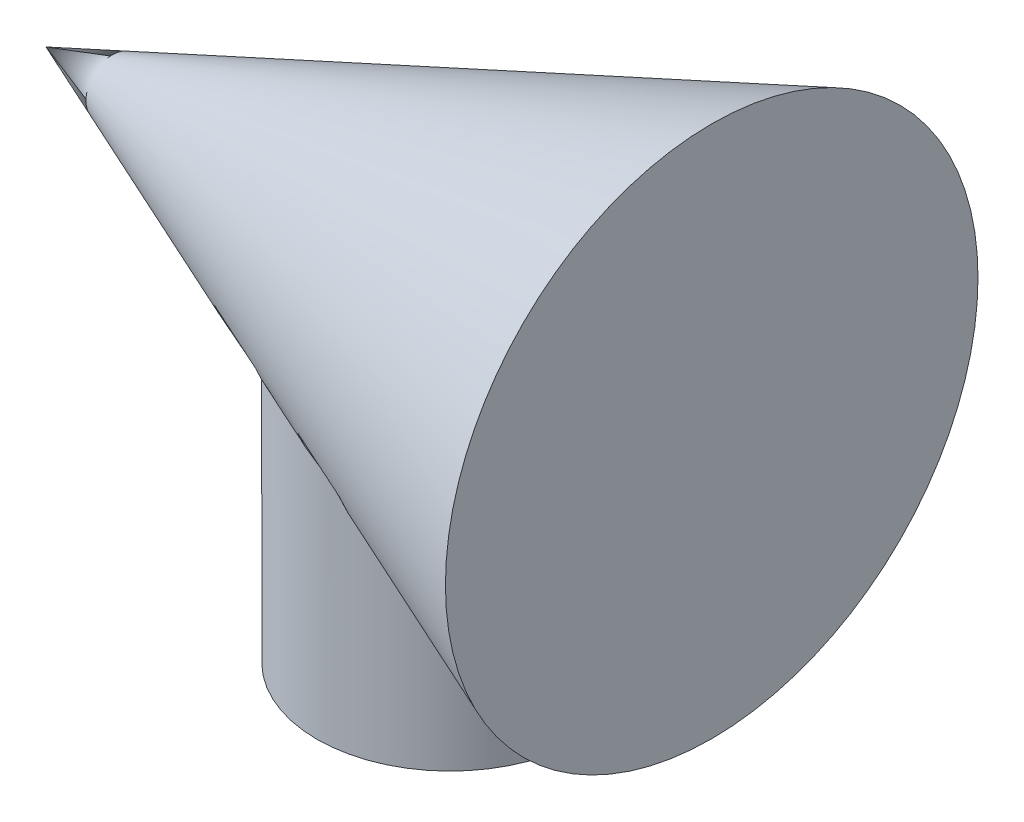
SolidWorks part; units mm, degrees
ref_plane "前视基准面" through (0, 0, 0) normal (0, 0, 1) x (1, 0, 0)
ref_plane "上视基准面" through (0, 0, 0) normal (0, 1, 0) x (1, 0, 0)
ref_plane "右视基准面" through (0, 0, 0) normal (1, 0, 0) x (0, 0, -1)
sketch "草图1" plane through (0, 0, 0) normal (0, 0, 1) x (1, 0, 0)
  line L0 (-68.1691, 0) -> (70.4103, 0) construction
  line L1 (-56.2162, 0) -> (-6.2162, 20)
  line L2 (-6.2162, 20) -> (-6.2162, 0)
  line L3 (-56.2162, 0) -> (-6.2162, 0)
  dimension "D1" = 20
  dimension "D2" = 50
revolve "旋转1" add sketch "草图1" angle 360 about L0
sketch "草图2" plane through (0, 0, 0) normal (0, 0, 1) x (1, 0, 0)
  line L0 (-25.8705, 1.1851) -> (-25.8705, -26.1407) construction
  line L1 (-35.8705, 2.0941) -> (-35.8705, -24.8619)
  line L3 (-35.8705, -24.8619) -> (-25.8705, -24.8619)
  line L4 (-25.8705, -24.8619) -> (-25.8705, 3.6724)
  line L5 (-25.8705, 3.6724) -> (-35.8705, 2.0941)
  dimension "D1" = 10
revolve "旋转2" add sketch "草图2" angle 360 about L0
